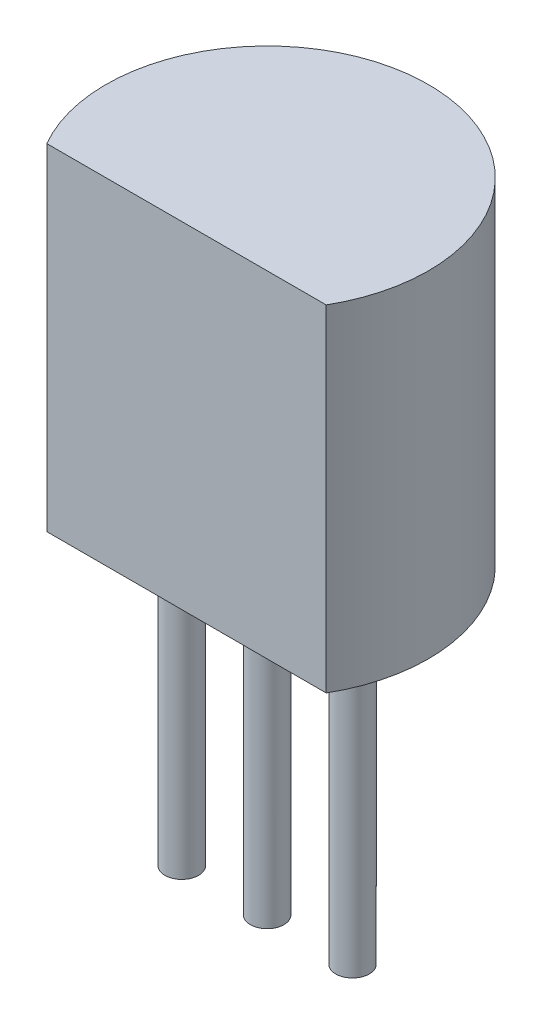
SolidWorks part; units mm, degrees
ref_plane "Plan de face" through (0, 0, 0) normal (0, 0, 1) x (1, 0, 0)
ref_plane "Plan de dessus" through (0, 0, 0) normal (0, 1, 0) x (1, 0, 0)
ref_plane "Plan de droite" through (0, 0, 0) normal (1, 0, 0) x (0, 0, -1)
sketch "Esquisse2" plane through (0, 0, 0) normal (0, 1, 0) x (1, 0, 0)
  line L0 (-2.0785, -1.2) -> (2.0785, -1.2)
  arc A0 (2.0785, -1.2) -> (-2.0785, -1.2) centre (0, 0) ccw
  dimension "D1" = 4.8
  dimension "D2" = 1.2
extrude "Extrusion1" add sketch "Esquisse2" along normal blind 5
sketch "Esquisse5" plane through (0, 0, 0) normal (0, -1, 0) x (1, 0, 0)
  line L0 (-1, 0) -> (0, 0) construction
  line L1 (0, 0) -> (1, 0) construction
  circle A0 centre (0, 0) radius 0.25
  circle A1 centre (-1, 0) radius 0.25
  circle A2 centre (1, 0) radius 0.25
  dimension "D1" = 0.5
  dimension "D2" = 2
sketch "Esquisse4" plane through (0, 0, 0) normal (0, 0, 1) x (1, 0, 0)
  line L0 (0, 0) -> (0, -4)
  line L1 (-1, 0) -> (-1, -0.871)
  line L2 (-1.25, 0) -> (-0.75, 0) construction
  line L3 (-1, -0.871) -> (-2.5, -2.1025)
  line L4 (-2.5, -2.1025) -> (-2.5, -4)
  line L5 (1, 0) -> (1, -0.871)
  line L6 (0.75, 0) -> (1.25, 0) construction
  line L7 (1, -0.871) -> (2.5, -2.1025)
  line L8 (2.5, -2.1025) -> (2.5, -4)
  line L9 (-2.0785, 5) -> (2.0785, 5) construction
  dimension "D1" = 9
  dimension "D2" = 5
sketch "Esquisse6" plane through (0, 0, 0) normal (0, -1, 0) x (1, 0, 0)
  line L0 (2.9242, 0) -> (-0.9683, 0) construction
  line L1 (0, -0.9931) -> (0, 0.8317) construction
  circle A0 centre (0, 0) radius 0.25
  circle A1 centre (0, 0) radius 0.25 construction
  circle A2 centre (1.27, 0) radius 0.25
  circle A3 centre (-1.27, 0) radius 0.25
  dimension "D1" = 2
extrude "Boss.-Extru.1" add sketch "Esquisse6" along normal blind 4.5
